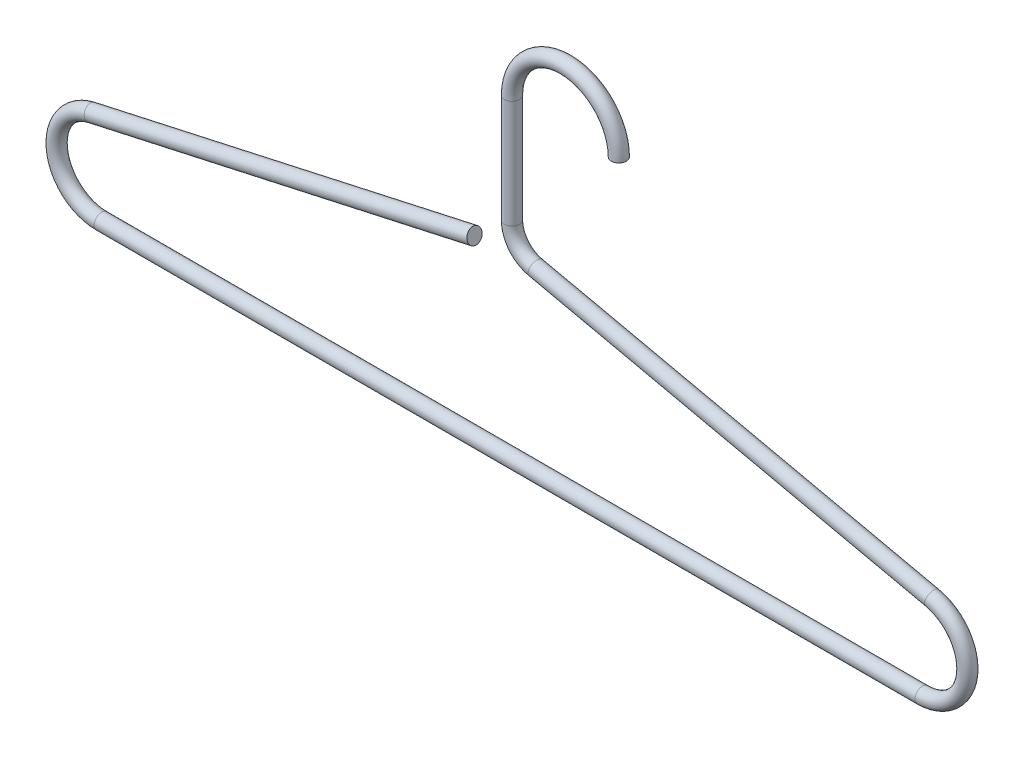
SolidWorks part; units mm, degrees
ref_plane "Front" through (0, 0, 0) normal (0, 0, 1) x (1, 0, 0)
ref_plane "Top" through (0, 0, 0) normal (0, 1, 0) x (1, 0, 0)
ref_plane "Right" through (0, 0, 0) normal (1, 0, 0) x (0, 0, -1)
sketch "Sketch1" plane through (0, 0, 0) normal (0, 0, 1) x (1, 0, 0)
  line L0 (0, 55.1092) -> (0, 9.3984)
  line L1 (9.9572, -3.0019) -> (177.8074, -40.1285)
  line L2 (173.6932, -77.7789) -> (-173.6932, -77.7789)
  line L3 (0, 55.1092) -> (0, -137.465) construction
  line L4 (-177.8074, -40.1285) -> (-15.8778, -4.3114)
  arc A0 (45.217, 55.1092) -> (0, 55.1092) centre (22.6085, 55.1092) ccw
  arc A1 (177.8074, -40.1285) -> (173.6932, -77.7789) centre (173.6932, -58.7289) cw
  arc A2 (9.9572, -3.0019) -> (0, 9.3984) centre (12.7, 9.3984) cw
  arc A3 (-177.8074, -40.1285) -> (-173.6932, -77.7789) centre (-173.6932, -58.7289) ccw
  dimension "D1" = 12.7
  dimension "D2" = 19.05
ref_plane "Plane4" through (-15.8778, -4.3114, 0) normal (0.9764, 0.216, 0) x (0, 0, -1)
sketch "Sketch2" plane through (-15.8778, -4.3114, 0) normal (0.9764, 0.216, 0) x (0, 0, -1)
  circle A0 centre (0, 0) radius 3.175
  dimension "D1" = 6.35
sweep "Sweep1" add profiles "Sketch2" path "Sketch1"
